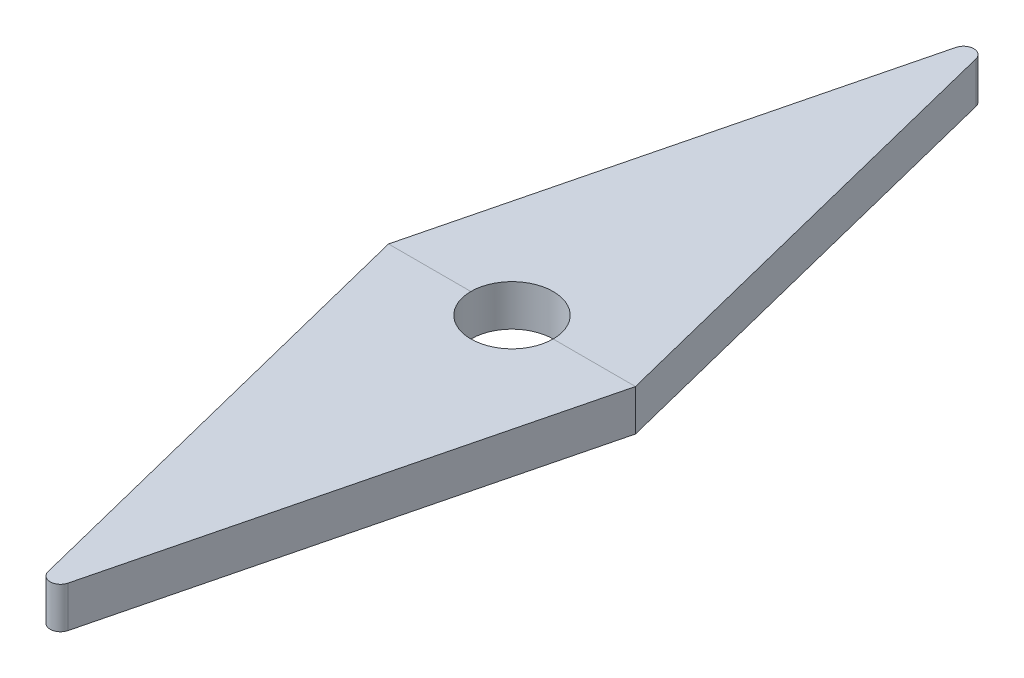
SolidWorks part; units mm, degrees
ref_plane "Front Plane" through (0, 0, 0) normal (0, 0, 1) x (1, 0, 0)
ref_plane "Top Plane" through (0, 0, 0) normal (0, 1, 0) x (1, 0, 0)
ref_plane "Right Plane" through (0, 0, 0) normal (1, 0, 0) x (0, 0, -1)
body saved out of another part "Stock-Compass Part-1"
